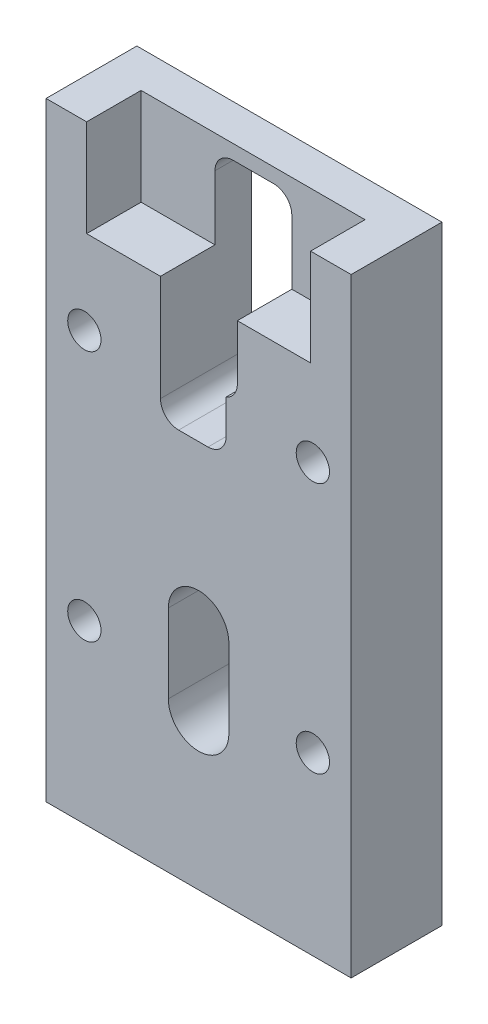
SolidWorks part; units mm, degrees
ref_plane "Front Plane" through (0, 0, 0) normal (0, 0, 1) x (1, 0, 0)
ref_plane "Top Plane" through (0, 0, 0) normal (0, 1, 0) x (1, 0, 0)
ref_plane "Right Plane" through (0, 0, 0) normal (1, 0, 0) x (0, 0, -1)
sketch "Sketch1" plane through (0, 0, 0) normal (0, 0, 1) x (1, 0, 0)
  line L1 (-25.2, -50.325) -> (25.2, -50.325)
  line L2 (-25.2, -50.325) -> (-25.2, 50.325)
  line L3 (-25.2, 50.325) -> (25.2, 50.325)
  line L4 (25.2, -50.325) -> (25.2, 50.325)
  line L5 (-25.2, -50.325) -> (25.2, 50.325) construction
  line L6 (-25.2, 50.325) -> (25.2, -50.325) construction
  point P0 (0, 0)
  dimension "D1" = 50.4
  dimension "D2" = 100.65
extrude "Boss-Extrude1" add sketch "Sketch1" along normal blind 15
sketch "Sketch2" plane through (0, 0, 15) normal (0, 0, 1) x (1, 0, 0)
  line L0 (25.2, 50.325) -> (-25.2, 50.325) construction
  line L1 (18.5, 50.325) -> (-18.5, 50.325)
  line L2 (18.5, 50.325) -> (18.5, 34.325)
  line L3 (18.5, 34.325) -> (-18.5, 34.325)
  line L4 (-18.5, 50.325) -> (-18.5, 34.325)
  point P6 (0, 50.325)
  point P7 (0, 50.325)
  dimension "D1" = 37
  dimension "D2" = 16
extrude "Cut-Extrude1" cut sketch "Sketch2" against normal offset from surface (9 mm away) 6
sketch "Sketch3" plane through (0, 0, 0) normal (0, 0, -1) x (-1, 0, 0)
  line L0 (0, -25.475) -> (0, -12.475) construction
  line L1 (-5, -25.475) -> (-5, -12.475)
  line L2 (5, -25.475) -> (5, -12.475)
  line L3 (0, -7.475) -> (0, -30.475) construction
  line L5 (6.3, 13.825) -> (6.3, 47.925)
  line L6 (6.3, 47.925) -> (-6.4, 47.925)
  line L7 (-6.4, 47.925) -> (-6.4, 22.475)
  line L8 (-6.4, 22.475) -> (-4.55, 22.475)
  line L9 (-4.55, 22.475) -> (-4.55, 13.825)
  line L10 (-4.55, 13.825) -> (6.3, 13.825)
  line L11 (-25.2, 50.325) -> (25.2, 50.325) construction
  line L12 (-25.2, -50.325) -> (-25.2, 50.325) construction
  arc A0 (-5, -25.475) -> (5, -25.475) centre (0, -25.475) ccw
  arc A1 (5, -12.475) -> (-5, -12.475) centre (0, -12.475) ccw
  point P3 (0, -18.975)
  dimension "D1" = 10
  dimension "D2" = 23
  dimension "D4" = 34.1
  dimension "D5" = 2.4
  dimension "D6" = 12.7
  dimension "D7" = 10.85
  dimension "D8" = 8.65
  dimension "D9" = 18.8
extrude "Cut-Extrude2" cut sketch "Sketch3" against normal through all
fillet "Fillet1" radius 3 5 edges at (-6.3, 13.825, 7.5) (-6.3, 47.925, 3) (6.4, 47.925, 3) (6.4, 22.475, 7.5) (4.55, 13.825, 7.5)
sketch "Sketch5" plane through (7.97, -1.0837, 0) normal (0, 0, -1) x (-1, 0, 0)
  line L0 (-10.905, 26.1087) -> (-10.905, 51.4087) construction
  line L2 (-15.63, 21.3837) -> (-17.23, 21.3837) construction
  line L4 (26.845, -24.8913) -> (26.845, -49.2413) construction
  line L6 (26.845, -49.2413) -> (33.17, -20.1663) construction
  line L8 (31.57, -20.1663) -> (33.17, -20.1663) construction
  line L11 (33.17, -49.2413) -> (-17.23, -49.2413) construction
  line L12 (-17.23, 51.4087) -> (33.17, 51.4087) construction
  line L13 (-17.23, -49.2413) -> (-17.23, 51.4087) construction
  line L14 (33.17, 51.4087) -> (33.17, -49.2413) construction
  circle A0 centre (26.845, 21.3837) radius 4.725
  circle A1 centre (26.845, -20.1663) radius 4.725
  circle A2 centre (-10.905, -20.1663) radius 4.725
  circle A3 centre (-10.905, 21.3837) radius 4.725
  dimension "D1" = 9.45
  dimension "D2" = 25.3
  dimension "D3" = 1.6
  dimension "D4" = 1.6
  dimension "D5" = 24.35
extrude "Cut-Extrude3" cut sketch "Sketch5" against normal blind 5
sketch "Sketch7" plane through (7.97, -1.0837, 0) normal (0, 0, -1) x (-1, 0, 0)
  circle A0 centre (-10.905, 21.3837) radius 2.75
  circle A1 centre (26.845, 21.3837) radius 2.75
  circle A2 centre (26.845, -20.1663) radius 2.75
  circle A3 centre (-10.905, -20.1663) radius 2.75
  circle A4 centre (-10.905, -20.1663) radius 4.725 construction
  circle A5 centre (26.845, -20.1663) radius 4.725 construction
  circle A6 centre (26.845, 21.3837) radius 4.725 construction
  circle A7 centre (-10.905, 21.3837) radius 4.725 construction
  dimension "D1" = 5.5
extrude "Cut-Extrude4" cut sketch "Sketch7" against normal through all
